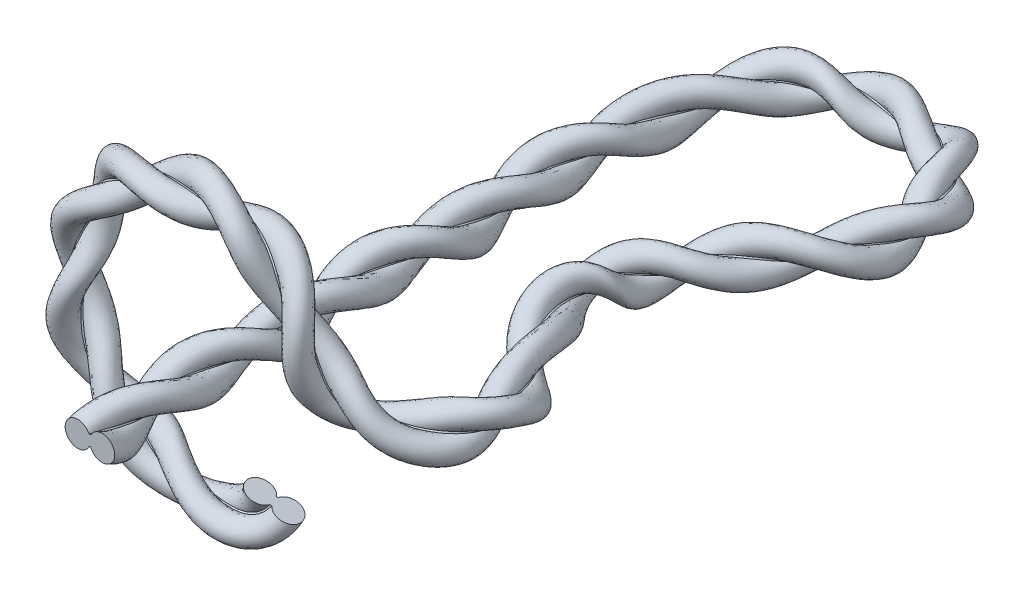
SolidWorks part; units mm, degrees
ref_plane "Front Plane" through (0, 0, 0) normal (0, 0, 1) x (1, 0, 0)
ref_plane "Top Plane" through (0, 0, 0) normal (0, 1, 0) x (1, 0, 0)
ref_plane "Right Plane" through (0, 0, 0) normal (1, 0, 0) x (0, 0, -1)
sketch3d "3DSketch1"
  line L0 (0, 0, 24.5863) -> (0, 0, -121.4637)
  spline S0 degree 3 poles (0, 0, -121.4637) (0, 0, -141.2351) (18.0811, 0.0175, -178.3824) (76.4273, -0.0664, -154.8502) (47.0197, 0.156, -103.3843) (19.6554, -0.8107, -81.6084) (63.812, 1.2457, -32.7084) (29.9949, -4.3172, -11.9595) (14.7816, 53.2103, -8.8189) (-52.2695, 27.9365, -9.9492) (-29.3493, -36.2739, -10.6069) (12.9788, -31.2163, -8.7546) (16.4848, -23.1695, -9.7157) knots 0 0 0 0 0.102265 0.235711 0.31248 0.422373 0.510557 0.610851 0.683826 0.804168 0.936718 1 1 1 1
  dimension "D1" = 146.05
ref_plane "Plane1" through (0, 0, 24.5863) normal (0, 0, -1) x (-1, 0, 0)
sketch "Sketch1" plane through (0, 0, 24.5863) normal (0, 0, -1) x (-1, 0, 0)
  line L1 (-0.8781, 1.5085) -> (-0.4182, 1.5085)
  line L3 (-0.8095, -1.3563) -> (-0.4868, -1.3563)
  arc A0 (-0.8781, 1.5085) -> (-0.8095, -1.3563) centre (-4.0185, 0) ccw
  arc A1 (-0.4868, -1.3563) -> (-0.4182, 1.5085) centre (2.7222, 0) ccw
sweep "Sweep1" add profiles "Sketch1" path "3DSketch1" parameters "D4"=4320
